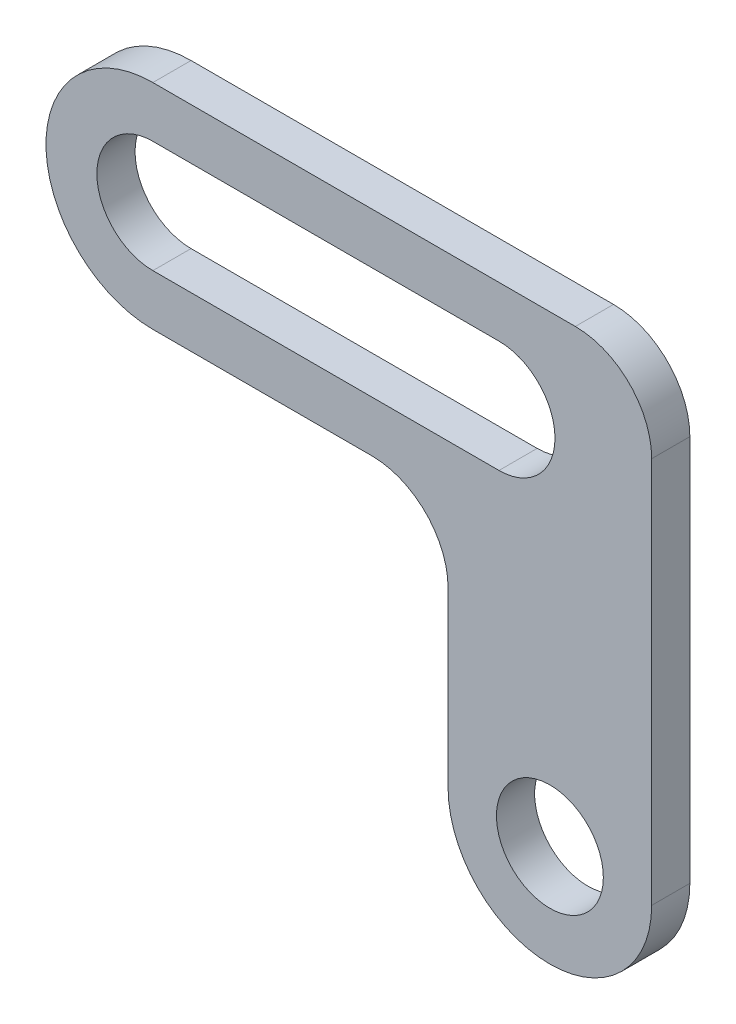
SolidWorks part; units mm, degrees
ref_plane "Plan de face" through (0, 0, 0) normal (0, 0, 1) x (1, 0, 0)
ref_plane "Plan de dessus" through (0, 0, 0) normal (0, 1, 0) x (1, 0, 0)
ref_plane "Plan de droite" through (0, 0, 0) normal (1, 0, 0) x (0, 0, -1)
sketch "Esquisse1" plane through (0, 0, 0) normal (0, 0, 1) x (1, 0, 0)
  line L1 (40, 0) -> (40, 182)
  line L2 (40, 182) -> (-156, 182)
  line L4 (-156, 98) -> (-40, 98)
  line L5 (-40, 98) -> (-40, 0)
  line L7 (-156, 162) -> (-20, 162)
  line L9 (-156, 118) -> (-20, 118)
  circle A0 centre (0, 0) radius 21
  arc A1 (-20, 118) -> (-20, 162) centre (-20, 140) ccw
  arc A2 (-156, 162) -> (-156, 118) centre (-156, 140) ccw
  arc A3 (-156, 182) -> (-156, 98) centre (-156, 140) ccw
  arc A4 (-40, 0) -> (40, 0) centre (0, 0) ccw
  dimension "D4" = 42
  dimension "D1" = 44
  dimension "D2" = 20
  dimension "D3" = 140
  dimension "D5" = 20
  dimension "D7" = 136
  dimension "D8" = 60
extrude "Boss.-Extru.1" add sketch "Esquisse1" along normal blind 15
fillet "Congé1" radius 30 2 edges at (-40, 98, 7.5) (40, 182, 7.5)
